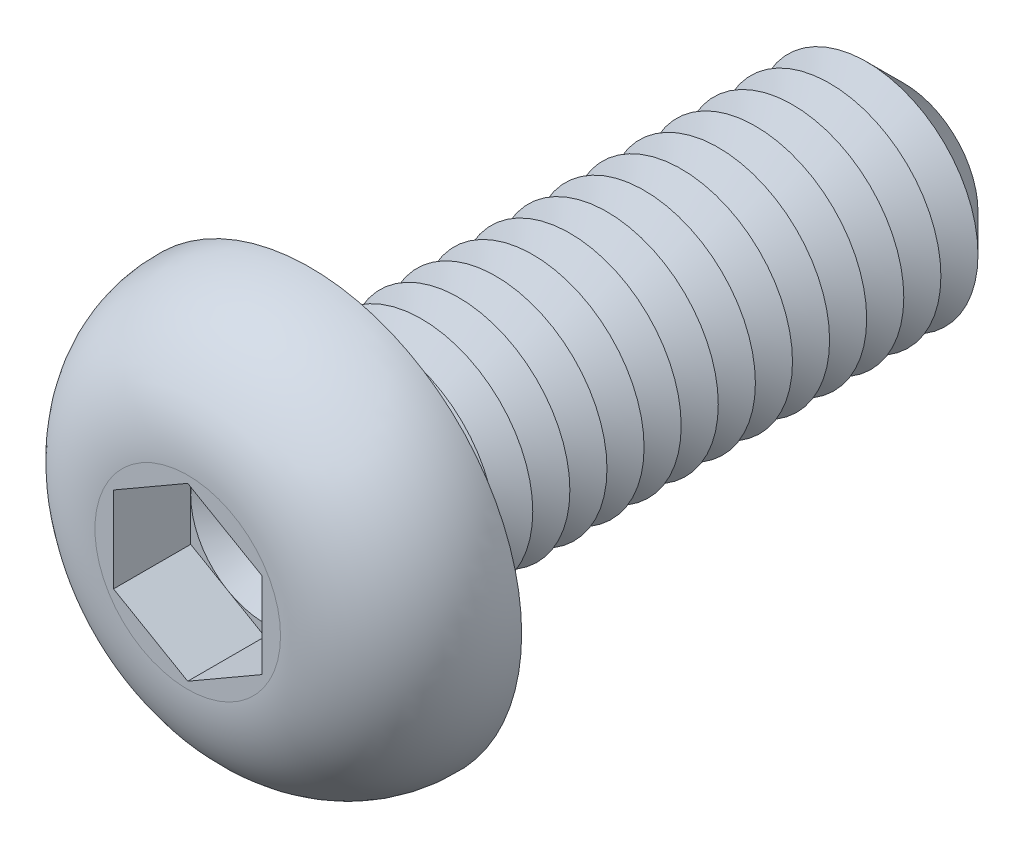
SolidWorks part; units mm, degrees
ref_plane "Front Plane" through (0, 0, 0) normal (0, 0, 1) x (1, 0, 0)
ref_plane "Top Plane" through (0, 0, 0) normal (0, 1, 0) x (1, 0, 0)
ref_plane "Right Plane" through (0, 0, 0) normal (1, 0, 0) x (0, 0, -1)
sketch "Sketch1" plane through (0, 0, 0) normal (1, 0, 0) x (0, 0, -1)
  line L0 (-47.9342, 0) -> (60.3146, 0) construction
sketch "Sketch2" plane through (0, 0, 0) normal (1, 0, 0) x (0, 0, -1)
  line L0 (0, 0) -> (-1.65, 0)
  line L1 (-47.9342, 0) -> (60.3146, 0) construction
  line L2 (-1.65, 0) -> (-1.65, 1.2508)
  line L3 (0, 2.85) -> (0, 0)
  arc A0 (-1.65, 1.2508) -> (0, 2.85) centre (-0.05, 1.2508) cw
  dimension "D1" = 1.6
  dimension "D2" = 1.65
  dimension "D3" = 2.85
revolve "Revolve1" add sketch "Sketch2" angle 360 about L0
sketch "Sketch3" plane through (0, 0, 1.65) normal (0, 0, 1) x (1, 0, 0)
  line L1 (0, 1.1547) -> (-1, 0.5774)
  line L2 (-1, 0.5774) -> (-1, -0.5774)
  line L3 (-1, -0.5774) -> (0, -1.1547)
  line L4 (0, -1.1547) -> (1, -0.5774)
  line L5 (1, -0.5774) -> (1, 0.5774)
  line L6 (1, 0.5774) -> (0, 1.1547)
  circle A0 centre (0, 0) radius 1 construction
  dimension "D1" = 2
extrude "Cut-Extrude1" cut sketch "Sketch3" against normal blind 1.04
sketch "Sketch4" plane through (0, 0, 0) normal (0, 0, -1) x (-1, 0, 0)
  circle A0 centre (0, 0) radius 1.5
  dimension "D1" = 3
extrude "Boss-Extrude1" add sketch "Sketch4" along normal blind 8
chamfer "Chamfer1" distance 0.5 angle 45 1 edges at (-1.5, 0, -8)
sketch "Sketch5" plane through (0, 0, 0) normal (1, 0, 0) x (0, 0, -1)
  line L0 (0.5, 1.5) -> (1, 1.5)
  line L1 (7.5, 1.5) -> (0, 1.5) construction
  line L2 (1, 1.5) -> (0.75, 1.067)
  line L3 (0.75, 1.067) -> (0.5, 1.5)
  line L4 (0, -2.85) -> (0, 2.85) construction
  line L5 (7.5, 1.5) -> (0, 1.5) construction
  dimension "D1" = 0.5
  dimension "D2" = 0.5
revolve "Cut-Revolve1" cut sketch "Sketch5" angle 360 about L0
pattern_linear "LPattern1" count 14 spacing 0.5 along (0, 0, -1) of "Cut-Revolve1"
fillet "Fillet2" radius 0.2 1 edges at (1.5, 0, 0)
sketch "Sketch6" plane through (0, 0, 0.61) normal (0, 0, 1) x (1, 0, 0)
  line L0 (0, -1.1547) -> (1, -0.5774) construction
  circle A0 centre (0, 0) radius 1
extrude "Cut-Extrude2" cut sketch "Sketch6" against normal through all draft 60
